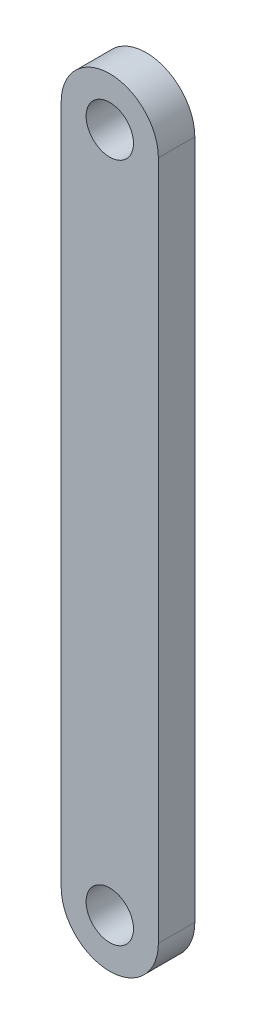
SolidWorks part; units mm, degrees
ref_plane "前视基准面" through (0, 0, 0) normal (0, 0, 1) x (1, 0, 0)
ref_plane "上视基准面" through (0, 0, 0) normal (0, 1, 0) x (1, 0, 0)
ref_plane "右视基准面" through (0, 0, 0) normal (1, 0, 0) x (0, 0, -1)
sketch "草图1" plane through (0, 0, 0) normal (0, 0, 1) x (1, 0, 0)
  line L0 (0, 0) -> (0, 56) construction
  line L1 (-4, 0) -> (-4, 56)
  line L2 (4, 0) -> (4, 56)
  arc A0 (-4, 0) -> (4, 0) centre (0, 0) ccw
  arc A1 (4, 56) -> (-4, 56) centre (0, 56) ccw
  point P3 (0, 28)
  dimension "D1" = 4
  dimension "D2" = 56
extrude "凸台-拉伸1" add sketch "草图1" along normal blind 3
hole_wizard "Ø3.9 (3.9) 直径孔2" positions "草图2" profile "草图3" hole size "Ø3.9" standard "GB"
sketch "草图2" plane through (0, 0, 3) normal (0, 0, 1) x (1, 0, 0)
  point P0 (0, 56)
  point P3 (0, 0)
sketch "草图3" plane through (0, 56, 3) normal (1, 0, 0) x (0, -1, 0)
  line L0 (0, 0) -> (0, 3)
  line L1 (0, 3) -> (1.95, 3)
  line L2 (1.95, 3) -> (1.95, 0)
  line L5 (1.95, 0) -> (0, 0)
  line L11 (0, -6.35) -> (0, 107.95) construction
  dimension "通孔孔直径" = 3.9
  dimension "通孔孔深度" = 3
